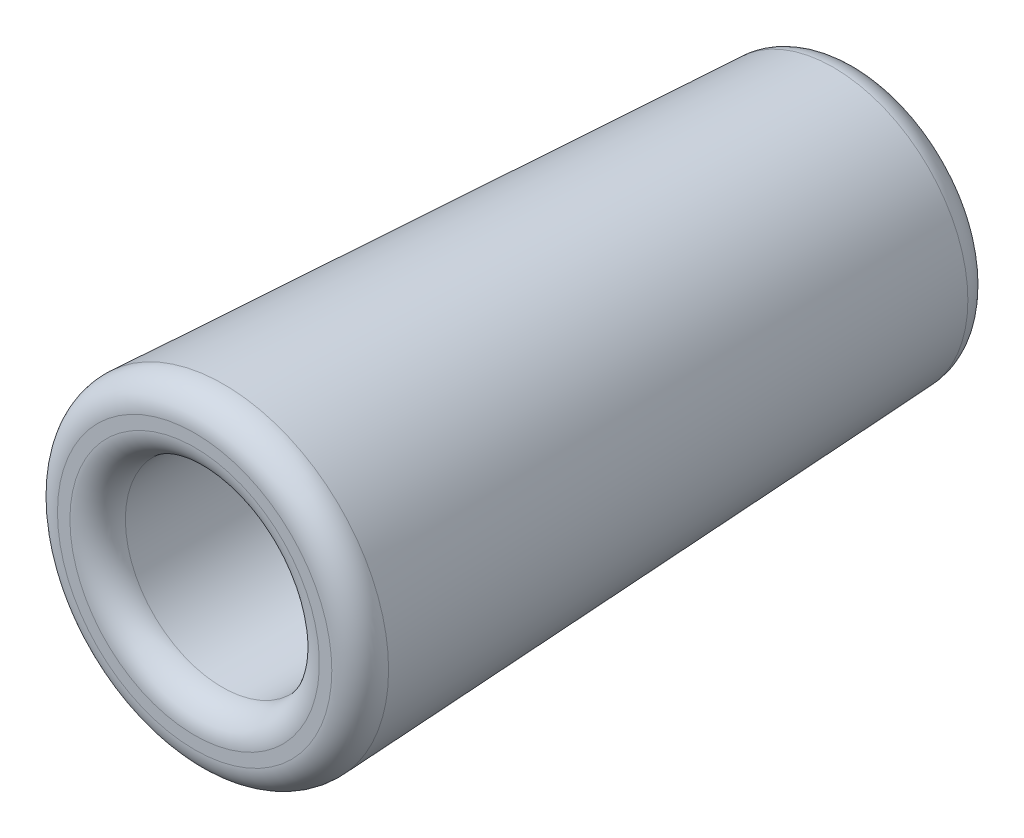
SolidWorks part; units mm, degrees
ref_plane "Спереди" through (0, 0, 0) normal (0, 0, 1) x (1, 0, 0)
ref_plane "Сверху" through (0, 0, 0) normal (0, 1, 0) x (1, 0, 0)
ref_plane "Справа" through (0, 0, 0) normal (1, 0, 0) x (0, 0, -1)
sketch "Эскиз1" plane through (0, 0, 0) normal (1, 0, 0) x (0, 0, -1)
  line L0 (6, 0) -> (12, 0)
  line L1 (12, 0) -> (12, 2.4)
  line L2 (12, 2.4) -> (0, 3)
  line L3 (0, 3) -> (0, 1.75)
  line L4 (0, 1.75) -> (6, 1.75)
  line L5 (6, 1.75) -> (6, 0)
  dimension "D1" = 12
  dimension "D2" = 1.75
  dimension "D3" = 3
  dimension "D4" = 2.4
  dimension "D5" = 6
revolve "Повернуть1" add sketch "Эскиз1" angle 360 about L0
fillet "Скругление1" radius 0.5 4 edges at (1.75, 0, 0) (1.75, 0, -6) (2.4, 0, -12) (3, 0, 0)
